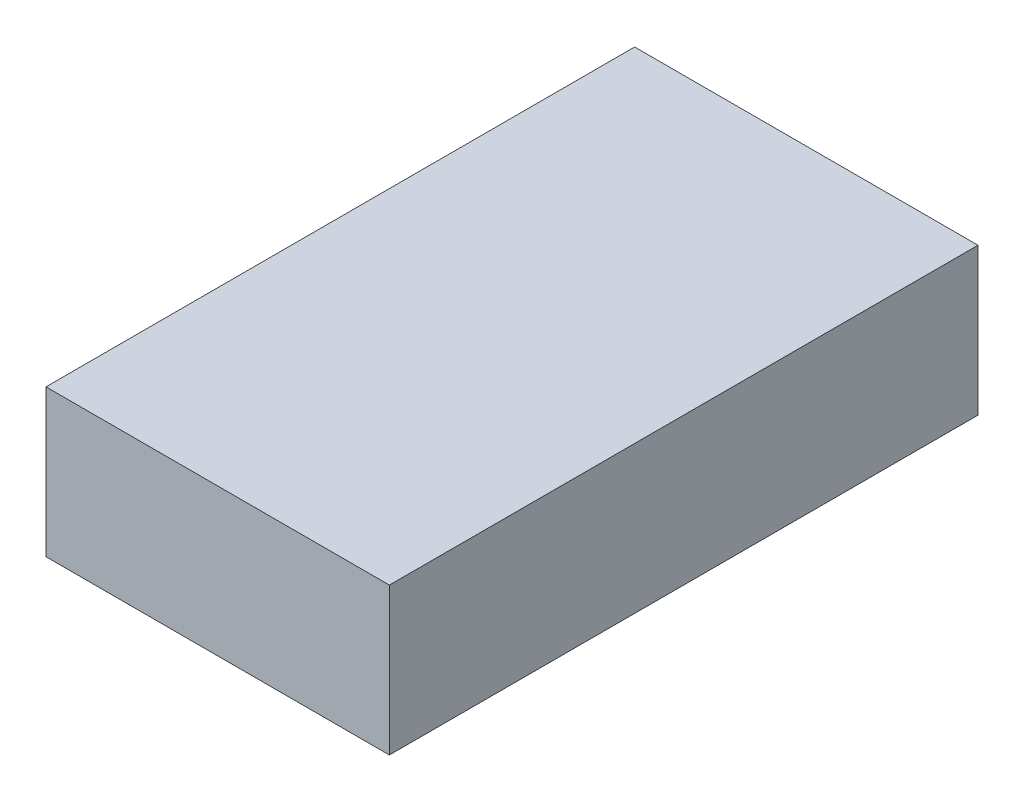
SolidWorks part; units mm, degrees
ref_plane "Front Plane" through (0, 0, 0) normal (0, 0, 1) x (1, 0, 0)
ref_plane "Top Plane" through (0, 0, 0) normal (0, 1, 0) x (1, 0, 0)
ref_plane "Right Plane" through (0, 0, 0) normal (1, 0, 0) x (0, 0, -1)
sketch "Sketch1" plane through (0, 0, 0) normal (0, 1, 0) x (1, 0, 0)
  line L1 (0, 0) -> (7, 0)
  line L2 (0, 0) -> (0, 12)
  line L3 (0, 12) -> (7, 12)
  line L4 (7, 0) -> (7, 12)
  dimension "D1" = 12
  dimension "D2" = 7
extrude "Boss-Extrude1" add sketch "Sketch1" along normal blind 3
